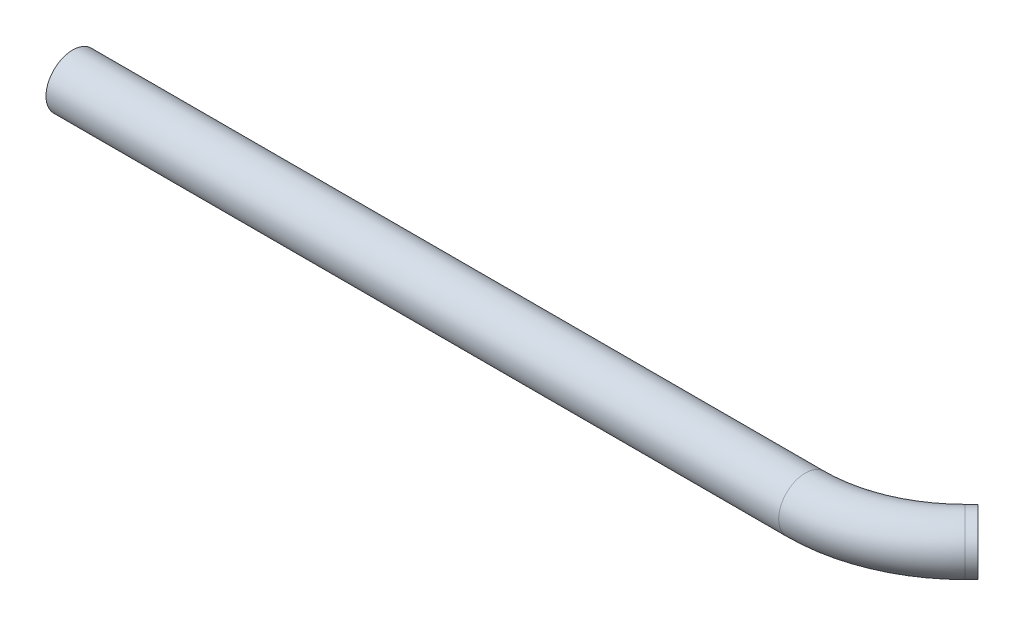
SolidWorks part; units mm, degrees
ref_plane "Front Plane" through (0, 0, 0) normal (0, 0, 1) x (1, 0, 0)
ref_plane "Top Plane" through (0, 0, 0) normal (0, 1, 0) x (1, 0, 0)
ref_plane "Right Plane" through (0, 0, 0) normal (1, 0, 0) x (0, 0, -1)
sketch "Sketch1" plane through (0, 0, 0) normal (0, 1, 0) x (1, 0, 0)
  line L0 (0, 0) -> (21.8398, 0)
  line L1 (25.2074, 1.3949) -> (25.4, 1.5875)
  arc A0 (25.2074, 1.3949) -> (21.8398, 0) centre (21.8398, 4.7625) cw
  dimension "D3" = 4.7625
  dimension "D1" = 135
  dimension "D2" = 1.5875
  dimension "D4" = 25.4
sketch "Sketch2" plane through (0, 0, 0) normal (1, 0, 0) x (0, 0, -1)
  circle A0 centre (0, 0) radius 0.7937
  dimension "D1" = 1.5875
sweep "Sweep1" add profiles "Sketch2" path "Sketch1"
ref_plane "Plane1" through (0, 0, 0) normal (0, 1, 0) x (1, 0, 0)
